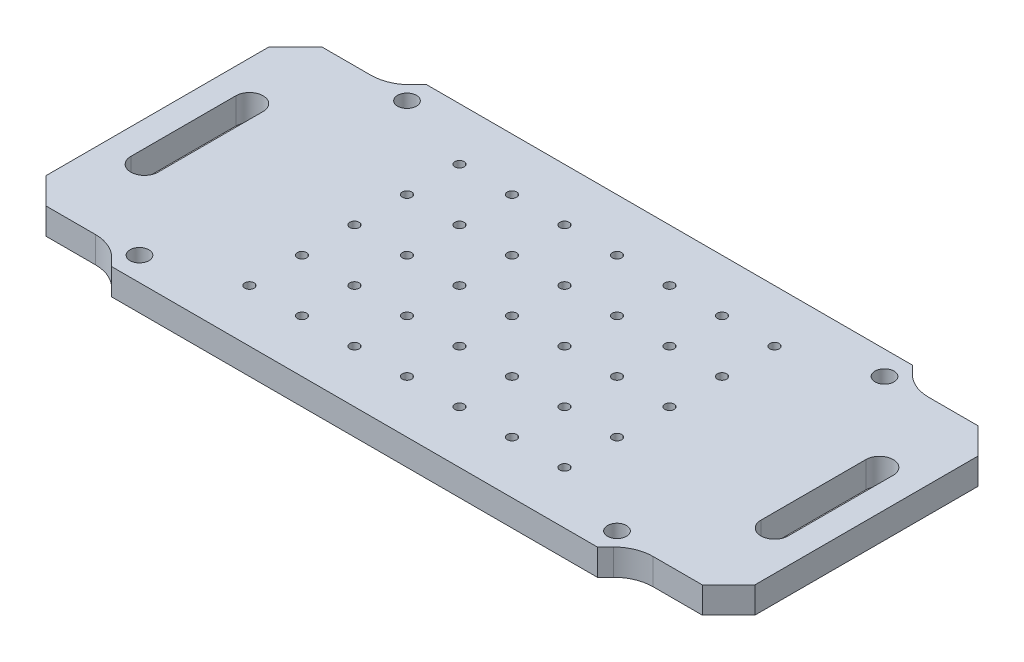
SolidWorks part; units mm, degrees
ref_plane "Front Plane" through (0, 0, 0) normal (0, 0, 1) x (1, 0, 0)
ref_plane "Top Plane" through (0, 0, 0) normal (0, 1, 0) x (1, 0, 0)
ref_plane "Right Plane" through (0, 0, 0) normal (1, 0, 0) x (0, 0, -1)
sketch "Sketch1" plane through (0, 0, 0) normal (0, 1, 0) x (1, 0, 0)
  line L1 (-63.5, -38.1) -> (63.5, -38.1)
  line L2 (-63.5, -38.1) -> (-63.5, 38.1)
  line L3 (-63.5, 38.1) -> (63.5, 38.1)
  line L4 (63.5, -38.1) -> (63.5, 38.1)
  line L5 (-63.5, -38.1) -> (63.5, 38.1) construction
  line L6 (-63.5, 38.1) -> (63.5, -38.1) construction
  point P0 (0, 0)
  dimension "D1" = 127
  dimension "D2" = 76.2
extrude "Boss-Extrude1" add sketch "Sketch1" along normal mid plane 6.35
chamfer "Chamfer1" distance 4.7625 angle 45 4 edges at (-63.5, 0, -38.1) (63.5, 0, -38.1) (63.5, 0, 38.1) (-63.5, 0, 38.1)
sketch "Sketch7" plane through (0, 3.175, 0) normal (0, 1, 0) x (1, 0, 0)
  line L0 (-61.1187, 35.7188) -> (-54.3836, 28.9836) construction
  line L1 (-58.7375, 38.1) -> (-63.5, 33.3375) construction
  circle A1 centre (-57.7512, 32.3512) radius 2.286
  dimension "D1" = 4.572
  dimension "D2" = 4.7625
extrude "Cut-Extrude1" cut sketch "Sketch7" against normal through all both and the other way through all
mirror "Mirror4" about plane through (0, 0, 0) normal (1, 0, 0) of "Cut-Extrude1"
mirror "Mirror5" about plane through (0, 0, 0) normal (0, 0, 1) of "Mirror4", "Cut-Extrude1"
sketch "Sketch12" plane through (0, 3.175, 0) normal (0, 1, 0) x (1, 0, 0)
  line L0 (-63.5, 33.3375) -> (-79.375, 33.3375)
  line L1 (-85.725, 26.9875) -> (-85.725, -26.9875)
  line L2 (-79.375, -33.3375) -> (-63.5, -33.3375)
  line L3 (-79.375, 33.3375) -> (-85.725, 26.9875)
  line L4 (-63.5, 33.3375) -> (-63.5, -33.3375)
  line L5 (-85.725, -26.9875) -> (-79.375, -33.3375)
  line L6 (85.725, -26.9875) -> (79.375, -33.3375)
  line L7 (-76.2, 12.7) -> (-76.2, -12.7) construction
  line L8 (-76.2, -12.7) -> (-63.5, -12.7) construction
  line L9 (-76.2, 0) -> (-63.5, 0) construction
  line L10 (0, 38.1) -> (0, -38.1) construction
  line L11 (58.7375, 38.1) -> (-58.7375, 38.1) construction
  line L12 (-58.7375, -38.1) -> (58.7375, -38.1) construction
  line L13 (79.375, -33.3375) -> (63.5, -33.3375)
  line L14 (85.725, 26.9875) -> (85.725, -26.9875)
  line L15 (63.5, 33.3375) -> (63.5, -33.3375)
  line L16 (63.5, 33.3375) -> (79.375, 33.3375)
  line L17 (79.375, 33.3375) -> (85.725, 26.9875)
  line L18 (-79.502, 12.7) -> (-79.502, -12.7)
  line L19 (-72.898, 12.7) -> (-72.898, -12.7)
  line L20 (72.898, 12.7) -> (72.898, -12.7)
  line L21 (79.502, 12.7) -> (79.502, -12.7)
  circle A0 centre (-76.2, 12.7) radius 3.302
  circle A1 centre (-76.2, -12.7) radius 3.302
  circle A2 centre (76.2, 12.7) radius 3.302
  circle A3 centre (76.2, -12.7) radius 3.302
  point P1 (-85.725, 33.3375)
  point P4 (-85.725, -33.3375)
  point P29 (85.725, -33.3375)
  point P31 (85.725, 33.3375)
  dimension "D2" = 6.604
  dimension "D3" = 6.604
  dimension "D1" = 152.4
  dimension "D4" = 25.4
  dimension "D5" = 22.225
extrude "Boss-Extrude4" add sketch "Sketch12" against normal up to surface (6.35 mm away) contours L1 L5 L2 L0 L3 A1 L18 A0 L19 M23 | L17 L16 L13 L6 L14 L21 A3 L20 A2 M27
fillet "Fillet1" radius 9.525 4 edges at (63.5, 0, -33.3375) (63.5, 0, 33.3375) (-63.5, 0, 33.3375) (-63.5, 0, -33.3375)
sketch "Sketch13" plane through (0, 3.175, 0) normal (0, 1, 0) x (1, 0, 0)
  circle A0 centre (-38.1, -25.4) radius 2.1627
  circle A1 centre (-25.4, -25.4) radius 2.1627
  circle A2 centre (-12.7, -25.4) radius 2.1627
  circle A3 centre (0, -25.4) radius 2.1627
  circle A4 centre (-25.4, -12.7) radius 2.1627
  circle A5 centre (-12.7, -12.7) radius 2.1627
  circle A6 centre (0, -12.7) radius 2.1627
  circle A7 centre (-25.4, 0) radius 2.1627
  circle A8 centre (-12.7, 0) radius 2.1627
  circle A9 centre (0, 0) radius 2.1627
  circle A10 centre (-38.1, -12.7) radius 2.1627
  circle A11 centre (-38.1, 0) radius 2.1627
  circle A12 centre (12.7, -25.4) radius 2.1627
  circle A13 centre (25.4, -25.4) radius 2.1627
  circle A14 centre (38.1, -25.4) radius 2.1627
  circle A15 centre (12.7, -12.7) radius 2.1627
  circle A16 centre (25.4, -12.7) radius 2.1627
  circle A17 centre (38.1, -12.7) radius 2.1627
  circle A18 centre (12.7, 0) radius 2.1627
  circle A19 centre (25.4, 0) radius 2.1627
  circle A20 centre (38.1, 0) radius 2.1627
  circle A21 centre (-38.1, 12.7) radius 2.1627
  circle A22 centre (-25.4, 12.7) radius 2.1627
  circle A23 centre (-12.7, 12.7) radius 2.1627
  circle A24 centre (0, 12.7) radius 2.1627
  circle A25 centre (12.7, 12.7) radius 2.1627
  circle A26 centre (25.4, 12.7) radius 2.1627
  circle A27 centre (38.1, 12.7) radius 2.1627
  circle A28 centre (-38.1, 25.4) radius 2.1627
  circle A29 centre (-25.4, 25.4) radius 2.1627
  circle A30 centre (-12.7, 25.4) radius 2.1627
  circle A31 centre (0, 25.4) radius 2.1627
  circle A32 centre (12.7, 25.4) radius 2.1627
  circle A33 centre (25.4, 25.4) radius 2.1627
  circle A34 centre (38.1, 25.4) radius 2.1627
  dimension "D3" = 12.7
  dimension "D4" = 12.7
  dimension "D1" = 7
  dimension "D2" = 5
hole_wizard "Tap Drill for #4-40 Tap1" positions "3DSketch1" profile "Sketch14" hole size "#4-40" standard "ANSI Inch"
sketch3d "3DSketch1"
  point P0 (-38.1, 3.175, -25.4)
  point P3 (-25.4, 3.175, -25.4)
  point P6 (-25.4, 3.175, -12.7)
  point P9 (-38.1, 3.175, -12.7)
  point P12 (-38.1, 3.175, 0)
  point P15 (-25.4, 3.175, 0)
  point P18 (-25.4, 3.175, 12.7)
  point P21 (-38.1, 3.175, 12.7)
  point P24 (-38.1, 3.175, 25.4)
  point P27 (-25.4, 3.175, 25.4)
  point P30 (-12.7, 3.175, 25.4)
  point P33 (-12.7, 3.175, 12.7)
  point P36 (-12.7, 3.175, 0)
  point P39 (-12.7, 3.175, -12.7)
  point P42 (-12.7, 3.175, -25.4)
  point P45 (0, 3.175, -25.4)
  point P48 (0, 3.175, -12.7)
  point P51 (0, 3.175, 12.7)
  point P54 (0, 3.175, 0)
  point P57 (0, 3.175, 25.4)
  point P60 (12.7, 3.175, 25.4)
  point P63 (12.7, 3.175, 12.7)
  point P66 (12.7, 3.175, 0)
  point P69 (12.7, 3.175, -12.7)
  point P72 (12.7, 3.175, -25.4)
  point P75 (25.4, 3.175, -25.4)
  point P78 (25.4, 3.175, -12.7)
  point P81 (25.4, 3.175, 0)
  point P84 (25.4, 3.175, 12.7)
  point P87 (25.4, 3.175, 25.4)
  point P90 (38.1, 3.175, 25.4)
  point P93 (38.1, 3.175, 12.7)
  point P96 (38.1, 3.175, 0)
  point P99 (38.1, 3.175, -12.7)
  point P102 (38.1, 3.175, -25.4)
sketch "Sketch14" plane through (-38.1, 3.175, -25.4) normal (1, 0, 0) x (0, 0, 1)
  line L0 (0, 0) -> (0, 5.08)
  line L1 (0, 5.08) -> (1.1303, 4.4008)
  line L2 (1.1303, 4.4008) -> (1.1303, 0)
  line L5 (1.1303, 0) -> (0, 0)
  line L10 (0, 5.08) -> (-1.1303, 4.4008) construction
  line L11 (0, -6.35) -> (0, 107.95) construction
  dimension "Hole Dia." = 2.2606
  dimension "Hole Depth" = 5.08
  dimension "Drill Angle" = 118
